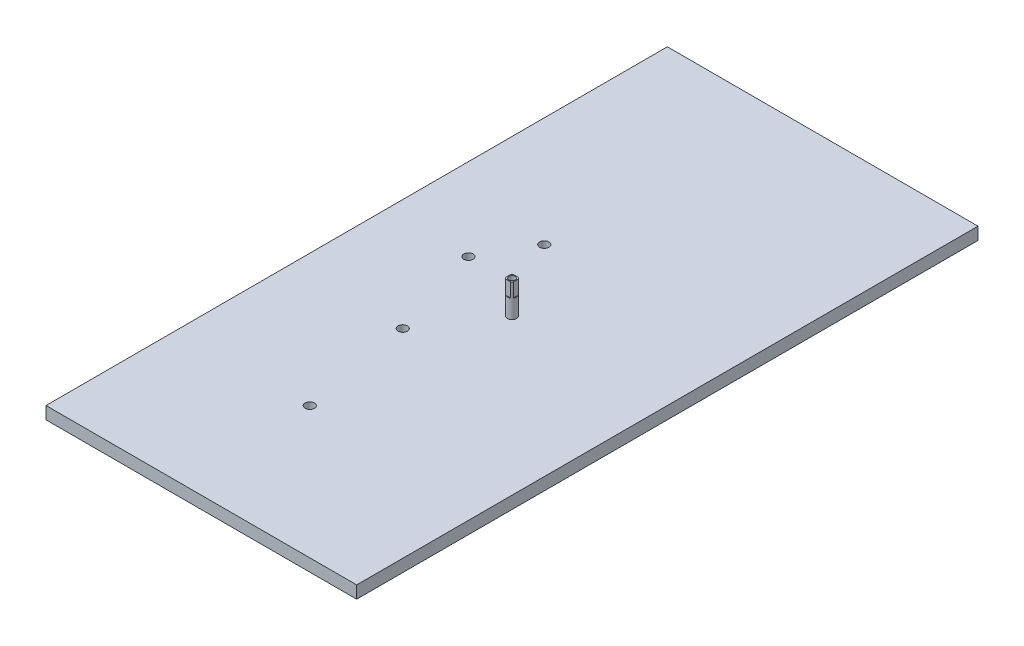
SolidWorks part; units mm, degrees
other "DetailItem1"
other "DetailItem4"
other "DetailItem5"
other "DetailItem6"
other "DetailItem7"
other "DetailItem8"
other "DetailItem9" parameters "D1"=130.8525, "D2"=69.4319, "D3"=36.4963, "D6"=12.8171, "D7"=5.2372, "D10"=14.4827, "D11"=5.361, "D14"=24.1385, "D15"=20.5722, "D17"=38.5709, "D19"=45.3058, "D22"=29.037, "D23"=48.8293, "D26"=23.3871, "D27"=9.5443, "D30"=7.2661, "D31"=33.8625, "D34"=24.3242, "D35"=7.7399, "D37"=19.4478, "D40"=16.1936, "D41"=5.7291, "D45"=13.6758, "D46"=22.4702, "D47"=36.4682, "D49"=70.9831, "D51"=12.9944, "D52"=19.8798, "D53"=33.549, "D55"=14.6272, "D58"=25.9, "D59"=4.812, "D61"=19.4793, "D66"=10.7086, "D67"=23.8166, "b3"=32, "b1"=223, "b2"=64, "D4"=32, "D5"=2.4589, "D8"=7.2455, "D9"=8.6909, "D12"=8.8045, "D13"=3.012, "D16"=2.6913, "D18"=4.7672, "D20"=1.0261, "D21"=1.3223, "D24"=8.5232, "D25"=4.2331, "D28"=9.8065, "D29"=3.1398, "D32"=14.9275, "D33"=6.4131, "D36"=5.6369, "D38"=5.0915, "D39"=2.1678, "D42"=6.9245, "D43"=3.6449, "D44"=2.0168, "D48"=2.1215, "D50"=2.0134, "D54"=10.9796, "D56"=6.0024, "D57"=3.0599, "D60"=4.877, "D62"=6.7641, "D63"=2.9135, "D64"=4.0127, "D65"=2.5645
other "DetailItem10"
other "DetailItem11"
other "DetailItem12"
other "DetailItem13"
other "DetailItem14"
other "DetailItem15"
other "DetailItem16"
other "DetailItem17"
other "DetailItem18"
other "DetailItem19"
other "DetailItem20"
other "DetailItem21"
other "DetailItem22"
ref_plane "Front Plane" through (0, 0, 0) normal (0, 0, 1) x (1, 0, 0)
ref_plane "Top Plane" through (0, 0, 0) normal (0, 1, 0) x (1, 0, 0)
ref_plane "Right Plane" through (0, 0, 0) normal (1, 0, 0) x (0, 0, -1)
sketch "Sketch1" plane through (-15.9155, 0, 0) normal (0, -1, 0) x (-1, 0, 0)
  line L2 (-15.9155, 0) -> (-15.9155, -72.75) construction
  line L36 (-15.9155, 72.75) -> (-15.9155, 0) construction
  circle A0 centre (-15.9155, 0) radius 55.4556
  circle A1 centre (-15.9155, 0) radius 15.9155
  circle A2 centre (-15.9155, 0) radius 7.9577
  circle A3 centre (7.6036, 9.5) radius 9.4498
  circle A4 centre (7.6036, 9.5) radius 11.9366
  circle A5 centre (-1.2491, 25.0633) radius 5.9683
  circle A6 centre (-1.2491, 25.0633) radius 31.5823
  circle A7 centre (-31.831, 0) radius 7.9577
  circle A8 centre (-31.831, 0) radius 7.9577
  circle A9 centre (-31.831, 0) radius 55.4556
  circle A10 centre (-31.831, 0) radius 46.7518
  circle A11 centre (-31.831, 0) radius 12.434
  circle A12 centre (-31.831, 0) radius 12.434
  circle A13 centre (-32.4072, 59.929) radius 13.18
  circle A14 centre (-32.4072, 59.929) radius 7.4604
  circle A15 centre (-15.9155, 72.75) radius 13.4287
  circle A16 centre (-15.9155, 72.75) radius 4.9736
  circle A17 centre (-31.2418, 85.4342) radius 14.9208
  circle A18 centre (-31.2418, 85.4342) radius 3.7302
  circle A19 centre (-44.9155, 72.75) radius 14.9208
  circle A20 centre (-1.8712, -21.1224) radius 9.4498
  circle A21 centre (-1.8712, -21.1224) radius 13.18
  circle A22 centre (-8.4179, -57.5928) radius 23.8732
  circle A23 centre (-8.4179, -57.5928) radius 6.7143
  circle A24 centre (-8.4179, -57.5928) radius 3.7302
  circle A25 centre (-15.9155, -72.75) radius 13.18
  circle A26 centre (-15.9155, -72.75) radius 14.1747
  circle A27 centre (-15.9155, -72.75) radius 3.7302
  circle A28 centre (-45.011, -72.75) radius 14.9208
  circle A29 centre (-4.5313, -87.5236) radius 14.9208
  circle A30 centre (-4.5313, -87.5236) radius 2.9842
  circle A31 centre (5.5845, -72.75) radius 14.9208
  circle A32 centre (-56.6989, 0) radius 12.434
  circle A33 centre (-56.6989, 0) radius 12.434
  point P5 (-15.9155, 72.75)
  point P109 (-15.9155, -72.75)
  point P110 (-15.9155, 0)
  point P113 (-15.9155, 0)
  point P121 (-15.9155, 0)
sketch "Sketch2" plane through (0, 0, 0) normal (0, 1, 0) x (1, 0, 0)
  line L1 (-50, -100) -> (50, -100)
  line L2 (-50, -100) -> (-50, 100)
  line L3 (-50, 100) -> (50, 100)
  line L4 (50, -100) -> (50, 100)
  line L5 (-50, -100) -> (50, 100) construction
  line L6 (-50, 100) -> (50, -100) construction
  point P0 (0, 0)
  dimension "D1" = 100
  dimension "D2" = 200
extrude "Boss-Extrude1" add sketch "Sketch2" along normal blind 4
sketch "Sketch3" plane through (0, 0, 0) normal (0, 1, 0) x (1, 0, 0)
  circle A0 centre (16.4917, 59.929) radius 1.5
  circle A1 centre (0, 72.75) radius 1.5
  circle A2 centre (29, 72.75) radius 1.5
  circle A3 centre (15.3263, 85.4342) radius 1.5
  circle A4 centre (15.9155, 0) radius 1
  circle A5 centre (-7.4976, -57.5928) radius 1.5
  circle A6 centre (0, -72.75) radius 1.5
  circle A7 centre (-11.3842, -87.5236) radius 1.5
  circle A8 centre (29.0955, -72.75) radius 1.5
  circle A9 centre (-21.5, -72.75) radius 1.5
  circle A10 centre (-14.6664, 25.0633) radius 1.5
  dimension "D1" = 3
  dimension "D2" = 2
extrude "Cut-Extrude1" cut sketch "Sketch3" along normal blind 3
sketch "Sketch4" plane through (0, 4, 0) normal (0, 1, 0) x (1, 0, 0)
  circle A0 centre (-14.6664, 25.0633) radius 1.5
  circle A1 centre (-23.5191, 9.5) radius 1.5
  circle A2 centre (-14.0443, -21.1224) radius 1.5
  circle A3 centre (-7.4976, -57.5928) radius 1.5
  dimension "D1" = 3
extrude "Cut-Extrude2" cut sketch "Sketch4" against normal blind 3
sketch "Sketch5" plane through (0, 4, 0) normal (0, 1, 0) x (1, 0, 0)
  circle A0 centre (0, 0) radius 1
  dimension "D1" = 2
extrude "Cut-Extrude3" cut sketch "Sketch5" against normal up to surface (4 mm away)
sketch "Sketch8" plane through (0, 4, 0) normal (0, 1, 0) x (1, 0, 0)
  circle A0 centre (0, 0) radius 1
  circle A1 centre (0, 0) radius 1.5
  circle A2 centre (0, 0) radius 1 construction
  dimension "D1" = 0.5
extrude "Boss-Extrude3" add sketch "Sketch8" along normal blind 10.5
sketch "Sketch9" plane through (0, 14.5, 0) normal (0, 1, 0) x (1, 0, 0)
  line L1 (1.25, 1.25) -> (-1.25, 1.25)
  line L2 (1.25, 1.25) -> (1.25, -1.25)
  line L3 (1.25, -1.25) -> (-1.25, -1.25)
  line L4 (-1.25, 1.25) -> (-1.25, -1.25)
  line L5 (1.25, 1.25) -> (-1.25, -1.25) construction
  line L6 (1.25, -1.25) -> (-1.25, 1.25) construction
  line L7 (3, 3) -> (-3, 3)
  line L8 (3, 3) -> (3, -3)
  line L9 (3, -3) -> (-3, -3)
  line L10 (-3, 3) -> (-3, -3)
  line L11 (3, 3) -> (-3, -3) construction
  line L12 (3, -3) -> (-3, 3) construction
  point P0 (0, 0)
  point P6 (0, 0)
  dimension "D1" = 2.5
  dimension "D2" = 6
extrude "Cut-Extrude6" cut sketch "Sketch9" against normal blind 4.5
equation "\"b3\"=32"
equation "\"b2\"=64"
equation "\"b1\"=223"
equation "\"D1@Sketch1\"  = \"b1\" / pi * \"scale\""
equation "\"D2@Sketch1\"  = \"b2\" / pi * \"scale\""
equation "\"D3@Sketch1\"  = \"b3\" / pi * \"scale\""
equation "\"c1\"=38"
equation "\"c2\"=48"
equation "\"D6@Sketch1\"  = \"c1\" / pi * \"scale\""
equation "\"D7@Sketch1\"  = \"c2\" / pi * \"scale\""
equation "\"d2\"=127"
equation "\"d1\"= 24"
equation "\"D10@Sketch1\"  = \"d2\" / pi * \"scale\""
equation "\"D11@Sketch1\"  = \"d1\" / pi * \"scale\""
equation "\"e1\"=32"
equation "\"e2\"=32"
equation "\"D14@Sketch1\"  = \"e2\" / pi * \"scale\""
equation "\"D15@Sketch1\"  = \"e1\" / pi * \"scale\""
equation "\"e3\"=223"
equation "\"D17@Sketch1\"  = \"e3\" / pi * \"scale\""
equation "\"e4\"=188"
equation "\"D19@Sketch1\"  = \"e4\" / pi * \"scale\""
equation "\"e5\"=50"
equation "\"D22@Sketch1\"  = \"e5\" / pi * \"scale\""
equation "\"e6\"=50"
equation "\"D23@Sketch1\"  = \"e6\" / pi * \"scale\""
equation "\"f2\"=30"
equation "\"f1\"=53"
equation "\"D26@Sketch1\"  = \"f1\" / pi * \"scale\""
equation "\"D27@Sketch1\"  = \"f2\" / pi * \"scale\""
equation "\"g2\"=20"
equation "\"g1\"=54"
equation "\"D30@Sketch1\"  = \"g2\" / pi * \"scale\""
equation "\"D31@Sketch1\"  = \"g1\" / pi * \"scale\""
equation "\"h1\"=60"
equation "\"h2\"=15"
equation "\"D34@Sketch1\"  = \"h1\" / pi * \"scale\""
equation "\"D35@Sketch1\"  = \"h2\" / pi * \"scale\""
equation "\"i1\"=60"
equation "\"D37@Sketch1\"  = \"i1\" / pi * \"scale\""
equation "\"l1\"=38"
equation "\"l2\"=53"
equation "\"D41@Sketch1\"  = \"l2\" / pi * \"scale\""
equation "\"D40@Sketch1\"  = \"l1\" / pi * \"scale\""
equation "\"m1\"=96"
equation "\"m2\"=15"
equation "\"m3\"=27"
equation "\"D45@Sketch1\"  = \"m3\" / pi * \"scale\""
equation "\"D46@Sketch1\"  = \"m2\" / pi * \"scale\""
equation "\"D47@Sketch1\"  = \"m1\" / pi * \"scale\""
equation "\"n3\"=15"
equation "\"n2\"=57"
equation "\"n1\"=53"
equation "\"D51@Sketch1\"  = \"n1\" / pi * \"scale\""
equation "\"D52@Sketch1\"  = \"n2\" / pi * \"scale\""
equation "\"D53@Sketch1\"  = \"n3\" / pi * \"scale\""
equation "\"o1\"=60"
equation "\"D55@Sketch1\"  = \"o1\" / pi * \"scale\""
equation "\"p1\"=60"
equation "\"p2\"=12"
equation "\"D58@Sketch1\"  = \"p1\" / pi * \"scale\""
equation "\"D59@Sketch1\"  = \"p2\" / pi * \"scale\""
equation "\"q1\"= 60"
equation "\"D61@Sketch1\"  = \"q1\" / pi * \"scale\""
equation "\"scale\"= 1.5625'scaling factor"
equation "\"k1\"=50"
equation "\"k2\"=50"
equation "\"D66@Sketch1\"=\"k2\"/pi*\"scale\""
equation "\"D67@Sketch1\"=\"k1\"/pi*\"scale\""
